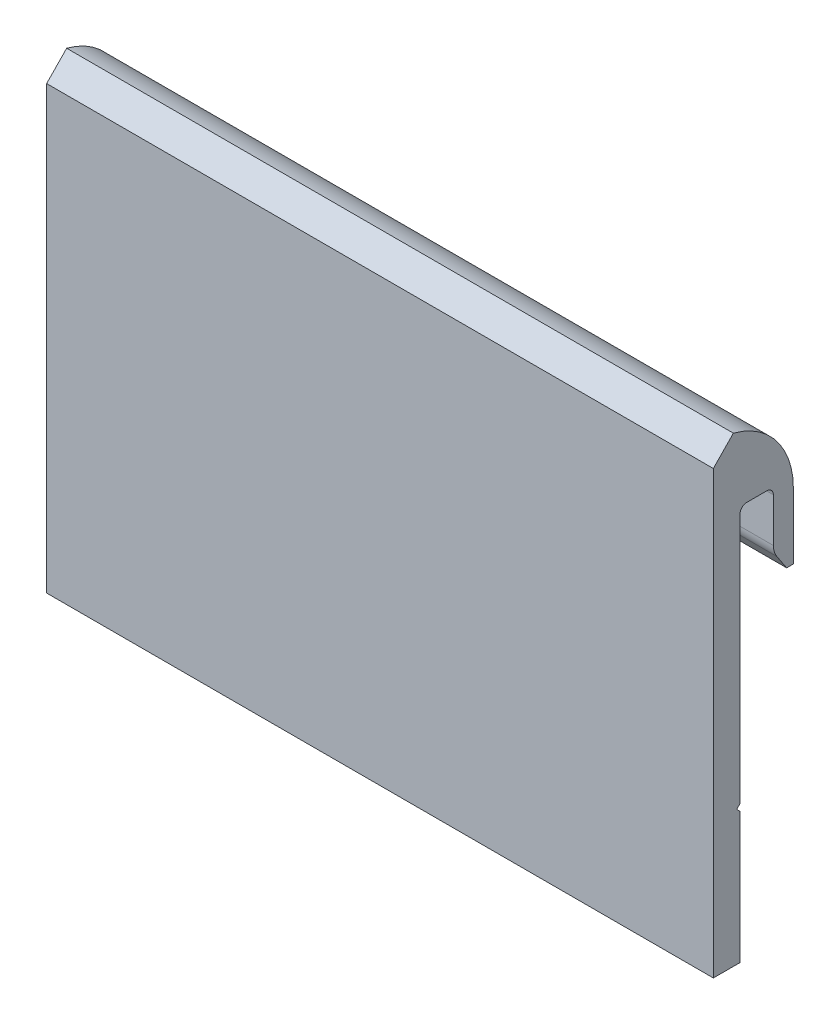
SolidWorks part; units mm, degrees
ref_plane "Front Plane" through (0, 0, 0) normal (0, 0, 1) x (1, 0, 0)
ref_plane "Top Plane" through (0, 0, 0) normal (0, 1, 0) x (1, 0, 0)
ref_plane "Right Plane" through (0, 0, 0) normal (1, 0, 0) x (0, 0, -1)
sketch "Sketch1" plane through (0, 0, 0) normal (-1, 0, 0) x (0, 0, 1)
  line L0 (-0.8219, 64.021) -> (-4.8219, 64.021)
  line L1 (-4.8219, 84.6751) -> (-4.3219, 84.1751)
  line L2 (-4.3219, 84.1751) -> (-4.8219, 83.6751)
  line L3 (-11.8219, 111.7941) -> (-10.3258, 114.0383)
  line L4 (-12.8219, 111.7941) -> (-11.8219, 111.7941)
  line L5 (-5.8219, 123.2941) -> (-8.8219, 123.2941)
  line L6 (-9.8219, 122.2941) -> (-9.8219, 115.7024)
  line L7 (-12.8219, 121.6751) -> (-12.8219, 111.7941)
  line L8 (-3.8219, 133.2941) -> (-0.8219, 130.206)
  line L9 (-0.8219, 130.206) -> (-0.8219, 64.021)
  line L10 (-4.8219, 83.6751) -> (-4.8219, 64.021)
  line L11 (-4.8219, 84.6751) -> (-4.8219, 122.2941)
  arc A0 (-3.8219, 133.2941) -> (-12.8219, 121.6751) centre (-0.8219, 121.6751) ccw
  arc A1 (-10.3258, 114.0383) -> (-9.8219, 115.7024) centre (-12.8219, 115.7024) ccw
  arc A2 (-8.8219, 123.2941) -> (-9.8219, 122.2941) centre (-8.8219, 122.2941) ccw
  arc A3 (-4.8219, 122.2941) -> (-5.8219, 123.2941) centre (-5.8219, 122.2941) ccw
extrude "Extrude1" add sketch "Sketch1" along normal mid plane 100
